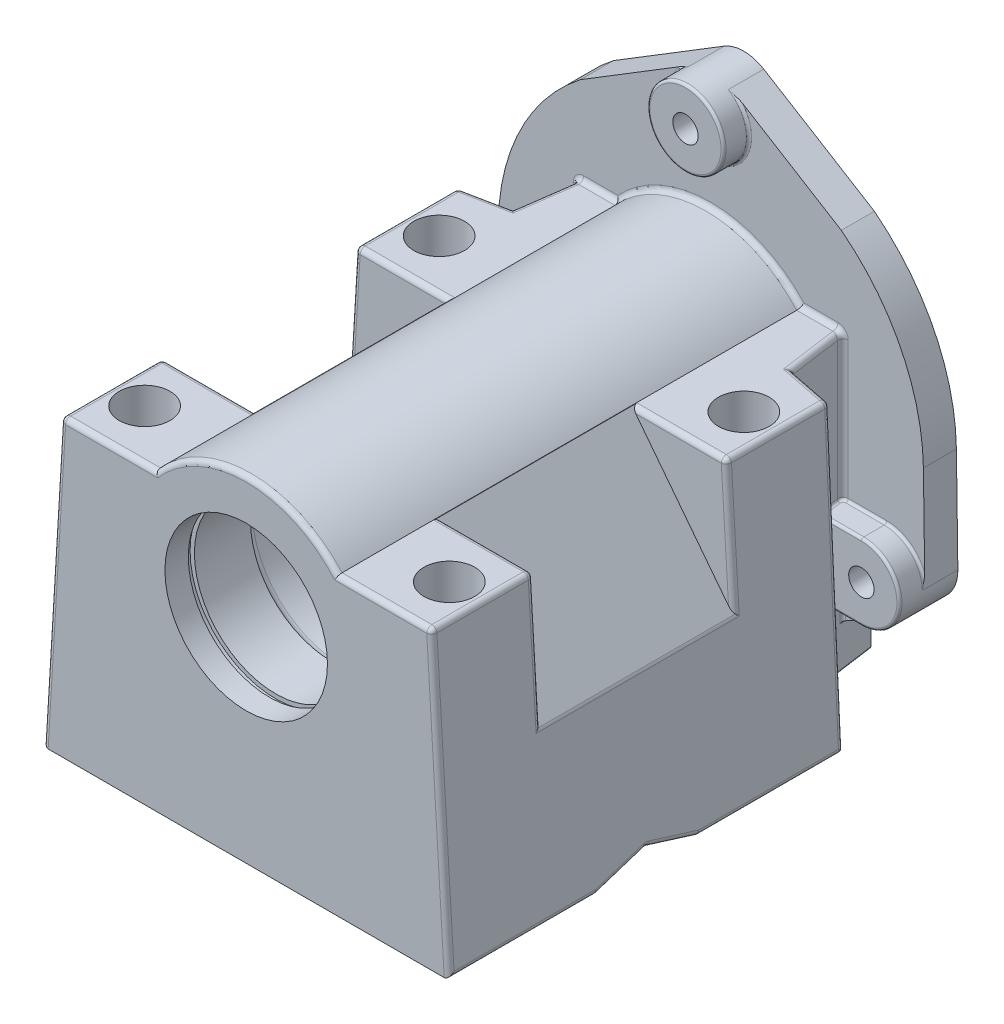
SolidWorks part; units mm, degrees
ref_plane "Face" through (0, 0, 0) normal (0, 0, 1) x (1, 0, 0)
ref_plane "Dessus" through (0, 0, 0) normal (0, 1, 0) x (1, 0, 0)
ref_plane "Droite" through (0, 0, 0) normal (1, 0, 0) x (0, 0, -1)
sketch "Esquisse1" plane through (0, 0, 0) normal (0, 0, 1) x (1, 0, 0)
  line L0 (-40, 0) -> (40, 0)
  line L1 (36.5, 58) -> (40, 0)
  line L2 (36.5, 58) -> (17.8885, 58)
  line L3 (0, 84.3826) -> (0, -40.1286) construction
  line L4 (-36.5, 58) -> (-17.8885, 58)
  line L5 (-36.5, 58) -> (-40, 0)
  circle A0 centre (0, 42) radius 16
  arc A1 (17.8885, 58) -> (-17.8885, 58) centre (0, 42) ccw
  point P12 (0, 0)
  dimension "D4" = 32
  dimension "D5" = 48
  dimension "D6" = 42
  dimension "D1" = 40
  dimension "D3" = 58
extrude "Extrusion1" add sketch "Esquisse1" along normal blind 98
sketch "Esquisse2" plane through (0, 0, 0) normal (0, -1, 0) x (1, 0, 0)
  line L0 (-40, 98) -> (40, 98) construction
  line L1 (40, 98) -> (40, 0) construction
  line L2 (0, 0) -> (0, 103.4282) construction
  line L3 (25, 0) -> (27.5, 18)
  line L4 (-40, 0) -> (40, 0) construction
  line L5 (27.5, 18) -> (40, 20.5)
  line L6 (-40, 0) -> (-25, 0)
  line L7 (-40, 20.5) -> (-40, 0)
  line L8 (-27.5, 18) -> (-40, 20.5)
  line L9 (40, 20.5) -> (40, 0)
  line L10 (40, 0) -> (25, 0)
  line L11 (-25, 0) -> (-27.5, 18)
  circle A0 centre (30, 88) radius 5
  circle A1 centre (30, 30) radius 5
  circle A2 centre (-30, 30) radius 5
  circle A3 centre (-30, 88) radius 5
  dimension "D1" = 10
  dimension "D2" = 10
  dimension "D3" = 10
  dimension "D4" = 25
  dimension "D5" = 18
  dimension "D6" = 2.5
  dimension "D7" = 2.5
extrude "Enlèv. mat.-Extru.1" cut sketch "Esquisse2" against normal through all
ref_plane "Plan1" through (0, 0, 78) normal (0, 0, 1) x (1, 0, 0)
sketch "Esquisse3" plane through (0, 0, 78) normal (0, 0, 1) x (1, 0, 0)
  line L0 (36.5, 58) -> (17.9662, 58)
  line L1 (36.5, 58) -> (38.069, 32)
  line L2 (40, 0) -> (36.5, 58) construction
  line L3 (38.069, 32) -> (17.9662, 58)
  line L4 (0, 70.3175) -> (0, -8.1964) construction
  line L5 (-38.069, 32) -> (-17.9662, 58)
  line L6 (-36.5, 58) -> (-38.069, 32)
  line L7 (-36.5, 58) -> (-17.9662, 58)
  arc A0 (17.8885, 58) -> (-17.8885, 58) centre (0, 42) ccw construction
  dimension "D1" = 26
extrude "Enlèv. mat.-Extru.2" cut sketch "Esquisse3" against normal blind 38
fillet "Congé1" radius 1
fillet "Congé3" radius 1
shell "Coque5" thickness 7
fillet "Congé5" radius 1
sketch "Esquisse4" plane through (0, 0, 0) normal (1, 0, 0) x (0, 0, -1)
  line L0 (-59, 73.4862) -> (-59, -8.217) construction
  line L1 (-59, 3) -> (-49, 0)
  line L2 (-20.2876, 0) -> (-98, 0) construction
  line L3 (-49, 0) -> (-69, 0)
  line L4 (-59, 3) -> (-69, 0)
  point P9 (-59, 0)
  dimension "D1" = 59
  dimension "D2" = 3
  dimension "D3" = 10
extrude "Enlèv. mat.-Extru.3" cut sketch "Esquisse4" against normal through all and the other way through all
fillet "Congé6" radius 1
sketch "Esquisse5" plane through (0, 0, 0) normal (0, 0, -1) x (-1, 0, 0)
  line L0 (0, 42) -> (0, 82) construction
  line L1 (0, 42) -> (34.641, 22) construction
  line L2 (3.9204, 88.3938) -> (25.691, 75.0448)
  line L3 (-3.9204, 88.3938) -> (-25.691, 75.0448)
  line L4 (41.8526, 42.5879) -> (42.1403, 22.1053)
  line L5 (38.2994, 15.4528) -> (20.4171, 5.4607)
  line L7 (-38.2994, 15.4528) -> (-20.4171, 5.4607)
  line L8 (-41.8526, 42.5879) -> (-42.1403, 22.1053)
  circle A0 centre (0, 42) radius 16
  circle A1 centre (0, 42) radius 16 construction
  arc A2 (-20.4171, 5.4607) -> (20.4171, 5.4607) centre (0, 42) ccw
  circle A3 centre (0, 82) radius 2.4584
  arc A4 (-25.691, 75.0448) -> (-41.8526, 42.5879) centre (0, 42) ccw
  arc A5 (3.9204, 88.3938) -> (-3.9204, 88.3938) centre (0, 82) ccw
  arc A6 (38.2994, 15.4528) -> (42.1403, 22.1053) centre (34.641, 22) ccw
  circle A7 centre (34.641, 22) radius 2.4584
  arc A8 (-42.1403, 22.1053) -> (-38.2994, 15.4528) centre (-34.641, 22) ccw
  circle A9 centre (-34.641, 22) radius 2.4584
  arc A10 (41.8526, 42.5879) -> (25.691, 75.0448) centre (0, 42) ccw
  dimension "D2" = 40
  dimension "D4" = 60
  dimension "D3" = 15
extrude "Extrusion5" add sketch "Esquisse5" against normal blind 6.5
sketch "Esquisse6" plane through (0, 0, 0) normal (0, 0, -1) x (-1, 0, 0)
  line L0 (0, 0) -> (0, 93.9815) construction
  line L1 (34.641, 14.5) -> (23.3291, 14.5)
  line L2 (-23.3291, 14.5) -> (-23.3291, 29.5)
  line L3 (34.641, 29.5) -> (23.3291, 29.5)
  line L4 (23.3291, 14.5) -> (23.3291, 29.5)
  line L5 (-34.641, 29.5) -> (-23.3291, 29.5)
  line L6 (-34.641, 14.5) -> (-23.3291, 14.5)
  circle A0 centre (0, 82) radius 7.5
  circle A2 centre (0, 82) radius 2.4584 construction
  arc A3 (34.641, 14.5) -> (34.641, 29.5) centre (34.641, 22) ccw
  circle A6 centre (34.641, 22) radius 2.4584 construction
  arc A10 (-34.641, 14.5) -> (-34.641, 29.5) centre (-34.641, 22) cw
  dimension "D1" = 15
  dimension "D2" = 15
extrude "Extrusion6" add sketch "Esquisse6" against normal blind 11.5
fillet "Congé8" radius 1
sketch "Esquisse9" plane through (0, 0, 0) normal (0, 0, -1) x (-1, 0, 0)
  circle A0 centre (0, 42) radius 35
  circle A1 centre (0, 42) radius 16 construction
  circle A2 centre (0, 42) radius 16
  dimension "D1" = 70
extrude "Extrusion7" add sketch "Esquisse9" along normal blind 1
sketch "Esquisse10" plane through (0, 0, -1) normal (0, 0, -1) x (-1, 0, 0)
  circle A0 centre (0, 42) radius 16
  circle A1 centre (0, 42) radius 16 construction
  circle A2 centre (0, 42) radius 28
  dimension "D1" = 32
  dimension "D2" = 56
extrude "Extrusion8" add sketch "Esquisse10" along normal blind 3
sketch "Esquisse11" plane through (0, 0, -1) normal (0, 0, -1) x (-1, 0, 0)
  circle A0 centre (0, 42) radius 29.4
  circle A1 centre (0, 42) radius 16 construction
  circle A2 centre (0, 42) radius 32.4
  dimension "D1" = 58.8
  dimension "D2" = 64.8
extrude "Enlèv. mat.-Extru.4" cut sketch "Esquisse11" against normal blind 1.8
ref_plane "Plan2" through (0, 0, 0) normal (0, 0, -1) x (-1, 0, 0)
sketch "Esquisse12" plane through (0, 0, 0) normal (0, 0, -1) x (-1, 0, 0)
  circle A0 centre (0, 42) radius 16
  circle A1 centre (0, 42) radius 16 construction
  circle A2 centre (0, 42) radius 16.85
  dimension "D1" = 33.7
extrude "Enlèv. mat.-Extru.5" cut sketch "Esquisse12" against normal blind 1.2
ref_plane "Plan3" through (0, 0, 92.2) normal (0, 0, -1) x (-1, 0, 0)
sketch "Esquisse13" plane through (0, 0, 92.2) normal (0, 0, -1) x (-1, 0, 0)
  circle A0 centre (0, 42) radius 16
  circle A1 centre (0, 42) radius 16 construction
  circle A2 centre (0, 42) radius 16.85
  dimension "D1" = 33.7
extrude "Enlèv. mat.-Extru.6" cut sketch "Esquisse13" against normal blind 1.2
hole_wizard "Trou taraudé M6x1.02" positions "Esquisse15" profile "Esquisse14" tap size "M6x1.0" standard "Ansi Métrique"
sketch "Esquisse15" plane through (0, 0, 0) normal (0, 0, -1) x (-1, 0, 0)
  arc A0 (3.9204, 88.3938) -> (-3.9204, 88.3938) centre (0, 82) ccw construction
  point P0 (0, 82)
sketch "Esquisse14" plane through (0, 82, 0) normal (1, 0, 0) x (0, 1, 0)
  line L0 (0, 0) -> (0, 11.501)
  line L1 (0, 11.501) -> (2.5, 11.501)
  line L2 (2.5, 11.501) -> (2.5, 0)
  line L5 (2.5, 0) -> (0, 0)
  line L11 (0, -6.35) -> (0, 107.95) construction
  dimension "Diamètre du trou pour taraudage jusqu'au prochain" = 5
  dimension "Profondeur du trou pour taraudage jusqu'au prochain" = 11.501
pattern_circular "Répétition circulaire1" count 3 over 360
fillet "Congé10" radius 0.5
sketch "Esquisse17" plane through (0, 0, 0) normal (1, 0, 0) x (0, 0, -1)
  line L0 (-93.4, 42) -> (9.9185, 42) construction
  line L1 (-92.2, 58.85) -> (-92.2, 25.15) construction
  line L2 (-79.2, 59.6058) -> (-14.2, 59.6058)
  line L3 (-81.2, 57.6058) -> (-81.2, 42)
  line L4 (-81.2, 42) -> (-12.2, 42)
  line L5 (-12.2, 57.6058) -> (-12.2, 42)
  line L6 (-1.2, 25.15) -> (-1.2, 58.85) construction
  arc A0 (-12.2, 57.6058) -> (-14.2, 59.6058) centre (-14.2, 57.6058) ccw
  arc A1 (-81.2, 57.6058) -> (-79.2, 59.6058) centre (-79.2, 57.6058) cw
  dimension "D3" = 2
  dimension "D1" = 11
  dimension "D2" = 11
revolve "Enlèvement de matière-Révolution1" cut sketch "Esquisse17" angle 360 about L0
